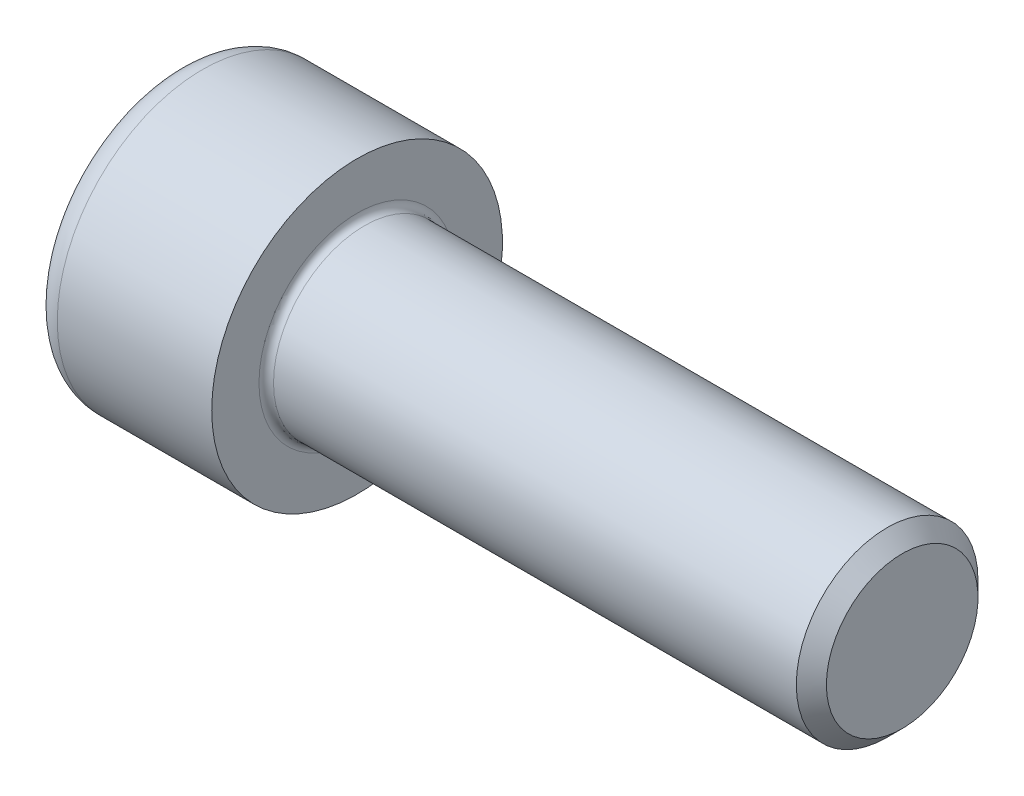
SolidWorks part; units mm, degrees
ref_plane "Plane1" through (0, 0, 0) normal (0, 0, 1) x (1, 0, 0)
ref_plane "Plane2" through (0, 0, 0) normal (0, 1, 0) x (1, 0, 0)
ref_plane "Plane3" through (0, 0, 0) normal (1, 0, 0) x (0, 0, -1)
sketch "BodySke" plane through (0, 0, 0) normal (0, 0, 1) x (1, 0, 0)
  line L0 (0, 0) -> (0, 8)
  line L1 (0, 8) -> (10, 8)
  line L2 (10, 8) -> (10, 5)
  line L3 (10, 5) -> (39.172, 5)
  line L4 (40, 4.172) -> (40, 0)
  line L5 (40, 0) -> (0, 0)
  line L6 (-31.75, 0) -> (127, 0) construction
  line L8 (40, 4.172) -> (39.172, 5)
  line L10 (40, -4.172) -> (39.172, -5) construction
  line L11 (11.5, 9.525) -> (11.5, 3.175) construction
  line L12 (10, 9.525) -> (10, 3.175) construction
  line L13 (-20, 9.525) -> (-20, 3.175) construction
  dimension "Diameter" = 10
  dimension "Head_ht" = 10
  dimension "Length" = 30
  dimension "Body_ch_ang" = 45
  dimension "Head_dia" = 16
  dimension "Minor_dia" = 8.344
  dimension "Advance" = 1.5
  dimension "Thread_nom" = 30
  dimension "Thread_length" = 60
revolve "Base-Revolve" add sketch "BodySke"
fillet "Fillet1" radius 0.4 1 edges at (10, 0, 5)
fillet "Fillet2" radius 1.5 1 edges at (0, 0, 8)
sketch "Sketch2" plane through (0, 0, 0) normal (0, 0, 1) x (1, 0, 0)
  line L0 (0, 4.0575) -> (5, 4.0575)
  line L1 (5, 4.0575) -> (7.3426, 0)
  line L2 (-31.75, 0) -> (127, 0) construction
  line L3 (7.3426, 0) -> (0, 0)
  line L4 (0, 0) -> (0, 4.0575)
  line L6 (0, 0) -> (47.625, 0) construction
  dimension "D1" = 4.0575
  dimension "D2" = 60
  dimension "Depth" = 5
revolve "Hex-PreBroach" cut sketch "Sketch2" angle 360 about L6
sketch "Sketch3" plane through (0, 0, 0) normal (-1, 0, 0) x (0, 0.5, 0.866)
  line L0 (2.3426, 4.0575) -> (-2.3426, 4.0575)
  line L1 (-2.3426, 4.0575) -> (-4.6852, 0)
  line L2 (2.3426, 4.0575) -> (4.6852, 0)
  line L3 (2.3426, -4.0575) -> (4.6852, 0)
  line L4 (2.3426, -4.0575) -> (-2.3426, -4.0575)
  line L5 (-2.3426, -4.0575) -> (-4.6852, 0)
  dimension "D1" = 4.0575
  dimension "D2" = 4.0575
  dimension "Hex_size" = 8.115
extrude "Hex" cut sketch "Sketch3" against normal blind 5
sketch "ThdSchSke" plane through (0, 0, 0) normal (0, 0, 1) x (1, 0, 0)
  line L0 (14.5, -4.172) -> (13.9202, -5)
  line L1 (14.5, -4.172) -> (15.0798, -5)
  line L2 (15.0798, -5) -> (15.0798, -6.25)
  line L3 (-3.175, 0) -> (5.1513, 0) construction
  line L4 (0, 6.5) -> (0, -6.5) construction
  line L5 (15.0798, -6.25) -> (13.9202, -6.25)
  line L6 (13.9202, -6.25) -> (13.9202, -5)
  dimension "Thread_minor" = 8.344
  dimension "Diameter" = 10
  dimension "Start" = 14.5
  dimension "SideAngle" = 55
  dimension "VeeAngle" = 70
  dimension "Overcut" = 12.5
revolve "ThreadSchematic" [suppressed] cut sketch "ThdSchSke" angle 360 about L3
pattern_linear "ThdSchPat" [suppressed]
equation "\"D2@Sketch3\" = \"Hex_size@Sketch3\" / 2"
equation "\"D1@Sketch3\" = \"Hex_size@Sketch3\" / 2"
equation "\"D1@Sketch2\" = \"Hex_size@Sketch3\" / 2"
equation "\"Thread_minor@ThreadCosmetic\"  =  \"Minor_dia@BodySke\""
equation "\"Depth@Sketch2\" =  \"Key_eng@Hex\""
equation "\"Thread_length@ThreadCosmetic\" = ((sgn( (\"Length@BodySke\" - \"Advance@BodySke\" * 3.0) - \"Thread_nom@BodySke\" )-1)*( (\"Length@BodySke\" - \"Advance@BodySke\" * 3.0) - \"Thread_nom@BodySke\" ))/-2+ \"Thread_no"
equation "\"Thread_minor@ThdSchSke\" = \"Minor_dia@BodySke\""
equation "\"Diameter@ThdSchSke\" = \"Diameter@BodySke\""
equation "\"Overcut@ThdSchSke\" = \"Diameter@BodySke\" * 1.25"
equation "\"Start@ThdSchSke\" = \"Head_ht@BodySke\" + \"Length@BodySke\" - \"Thread_length@ThreadCosmetic\"  '---Non-countersunk---"
equation "\"Num_threads@ThdSchPat\" = int( \"Thread_length@ThreadCosmetic\" / \"Advance@BodySke\" + 0.999 )  + 1"
equation "\"Advance@ThdSchPat\" = \"Thread_length@ThreadCosmetic\" /  (\"Num_threads@ThdSchPat\" - 1) 'relax it"
equation "\"Num_threads@ThdSchPat\" = \"Num_threads@ThdSchPat\" - sgn( \"Num_threads@ThdSchPat\" - 1) '---chamfered tips only---"
